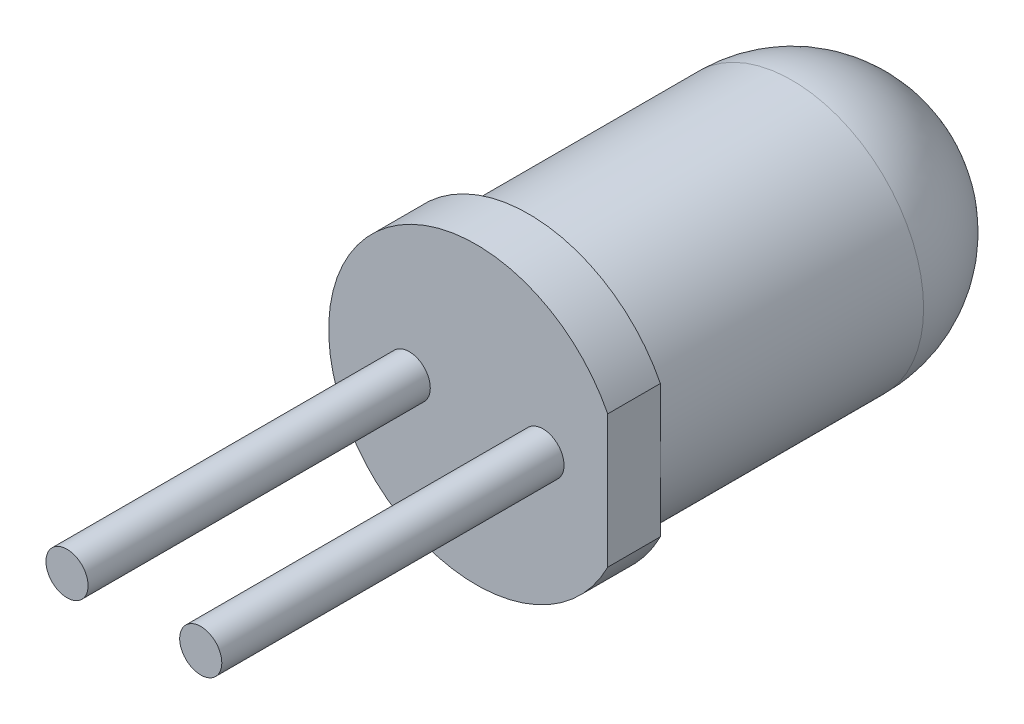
SolidWorks part; units mm, degrees
ref_plane "Face" through (0, 0, 0) normal (0, 0, 1) x (1, 0, 0)
ref_plane "Dessus" through (0, 0, 0) normal (0, 1, 0) x (1, 0, 0)
ref_plane "Droite" through (0, 0, 0) normal (1, 0, 0) x (0, 0, -1)
sketch "Esquisse1" plane through (0, 0, 0) normal (0, 0, 1) x (1, 0, 0)
  circle A0 centre (0, 0) radius 2.5
extrude "Base-Extrusion" add sketch "Esquisse1" along normal blind 8.5
sketch "Esquisse2" plane through (0, 0, 8.5) normal (0, 0, 1) x (1, 0, 0)
  line L0 (2.5, -2.4917) -> (2.5, 2.5621) construction
  line L1 (2.5, 1.261) -> (2.5, -1.261)
  arc A0 (2.5, 1.261) -> (2.5, -1.261) centre (0, 0) ccw
extrude "Boss.-Extru.1" add sketch "Esquisse2" against normal blind 1
fillet "Congé1" radius 2.5 1 edges at (2.5, 0, 0)
sketch "Esquisse3" plane through (0, 0, 8.5) normal (0, 0, 1) x (1, 0, 0)
  line L0 (2.8791, 0) -> (-3.5821, 0) construction
  line L1 (0, -2.9335) -> (0, 2.9813) construction
  line L2 (1.27, -0.8777) -> (1.27, 1.5607) construction
  circle A0 centre (1.27, 0) radius 0.4
  circle A1 centre (-1.27, 0) radius 0.4
  dimension "D2" = 2.54
extrude "Extrusion1" add sketch "Esquisse3" along normal blind 6.5 contours A0
sketch "Esquisse4" plane through (0, 0, 8.5) normal (0, 0, 1) x (1, 0, 0)
  line L0 (-3.0686, 0) -> (3.5367, 0) construction
  circle A0 centre (-1.27, 0) radius 0.4
  circle A1 centre (1.27, 0) radius 0.4 construction
  dimension "D1" = 2.54
extrude "Boss.-Extru.2" add sketch "Esquisse4" along normal blind 6.5
